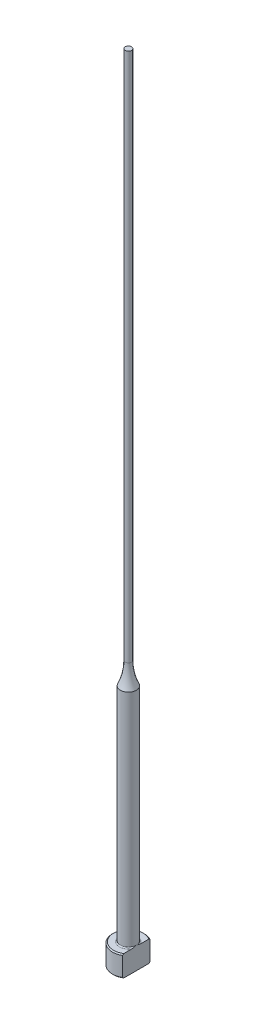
SolidWorks part; units mm, degrees
ref_plane "Front Plane" through (0, 0, 0) normal (0, 0, 1) x (1, 0, 0)
ref_plane "Top Plane" through (0, 0, 0) normal (0, 1, 0) x (1, 0, 0)
ref_plane "Right Plane" through (0, 0, 0) normal (1, 0, 0) x (0, 0, -1)
sketch "Sketch1" plane through (0, 0, 0) normal (0, 0, 1) x (1, 0, 0)
  line L0 (0, 259.9588) -> (0, -15.1925) construction
  line L1 (0, 0) -> (-3, 0)
  line L2 (-3, 0) -> (-3, 4)
  line L3 (-3, 4) -> (-1.5, 4)
  line L4 (-0.6, 50) -> (-0.6, 150)
  line L5 (-0.6, 150) -> (0, 150)
  line L6 (0, 150) -> (0, 0)
  line L7 (-1.5, 4) -> (-1.5, 45.8539)
  arc A0 (-1.5, 45.8539) -> (-0.6, 50) centre (-10.6, 50) ccw
  point P13 (-1.5, 0)
  dimension "D1" = 10
  dimension "L" = 150
  dimension "H" = 6
  dimension "T" = 4
  dimension "D" = 1.2
  dimension "B" = 3
  dimension "S" = 50
revolve "Revolve1" add sketch "Sketch1" angle 360 about L0
chamfer "Chamfer1" distance 0.2 angle 45 2 edges at (0, 4, 3) (0, 0, 3)
fillet "Fillet1" radius 0.2 1 edges at (0, 4, 1.5)
sketch "Sketch2" plane through (0, 0, 0) normal (0, 1, 0) x (1, 0, 0)
  line L0 (1.5, -2.5981) -> (1.5, 2.5981)
  circle A0 centre (0, 0) radius 3 construction
  arc A1 (1.5, -2.5981) -> (1.5, 2.5981) centre (0, 0) ccw
  circle A2 centre (0, 0) radius 1.5 construction
extrude "Keyed Head" cut sketch "Sketch2" along normal through all
